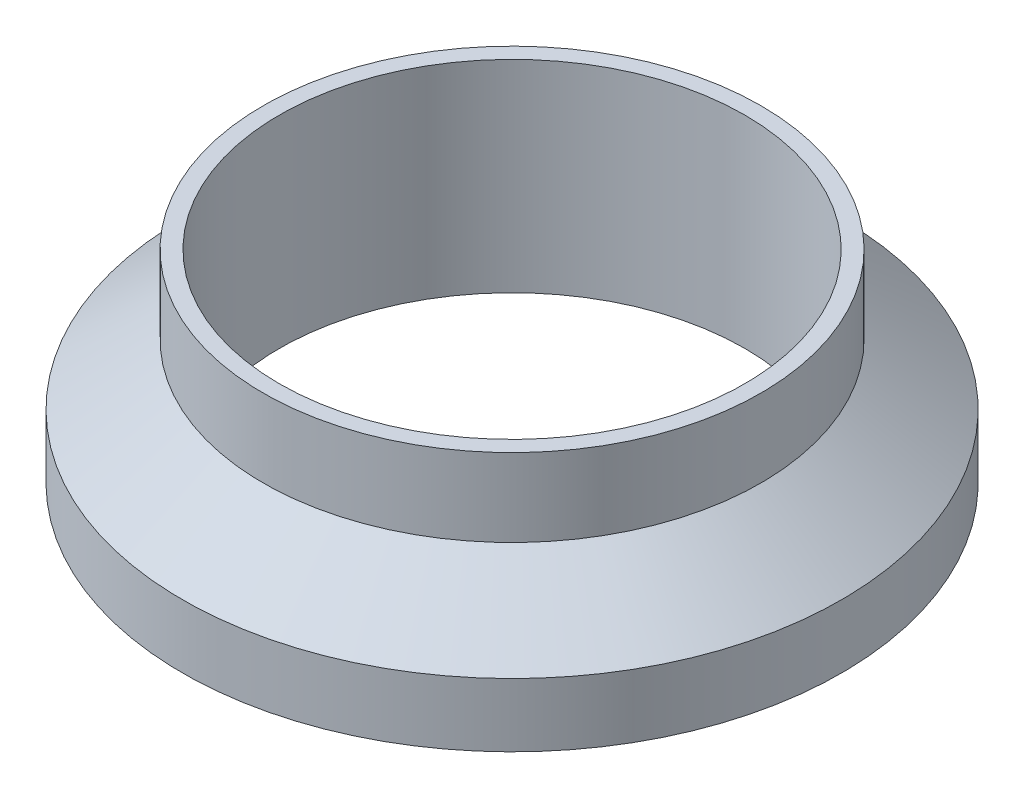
SolidWorks part; units mm, degrees
ref_plane "Front Plane" through (0, 0, 0) normal (0, 0, 1) x (1, 0, 0)
ref_plane "Top Plane" through (0, 0, 0) normal (0, 1, 0) x (1, 0, 0)
ref_plane "Right Plane" through (0, 0, 0) normal (1, 0, 0) x (0, 0, -1)
sketch "Sketch1" plane through (0, 0, 0) normal (0, 0, 1) x (1, 0, 0)
  line L0 (-23.749, 0) -> (-23.749, 20.6248)
  line L1 (-23.749, 20.6248) -> (-25.4, 20.6248)
  line L2 (-25.4, 20.6248) -> (-25.4, 12.6784)
  line L3 (-25.4, 12.6784) -> (-33.6296, 6.477)
  line L4 (-33.6296, 6.477) -> (-33.6296, 0)
  line L5 (-33.6296, 0) -> (-30.23, 0)
  line L6 (-23.749, 0) -> (-27.174, 0)
  line L7 (0, 0) -> (0, 37.9334) construction
  arc A0 (-27.174, 0) -> (-30.23, 0) centre (-28.702, -0.381) ccw
  dimension "D1" = 3.1496
  dimension "D2" = 23.749
  dimension "D3" = 25.4
  dimension "D4" = 28.702
  dimension "D5" = 33.6296
  dimension "D6" = 6.477
  dimension "D7" = 20.6248
  dimension "D8" = 127
  dimension "D9" = 0.381
revolve "Revolve1" add sketch "Sketch1" angle 360 about L7
